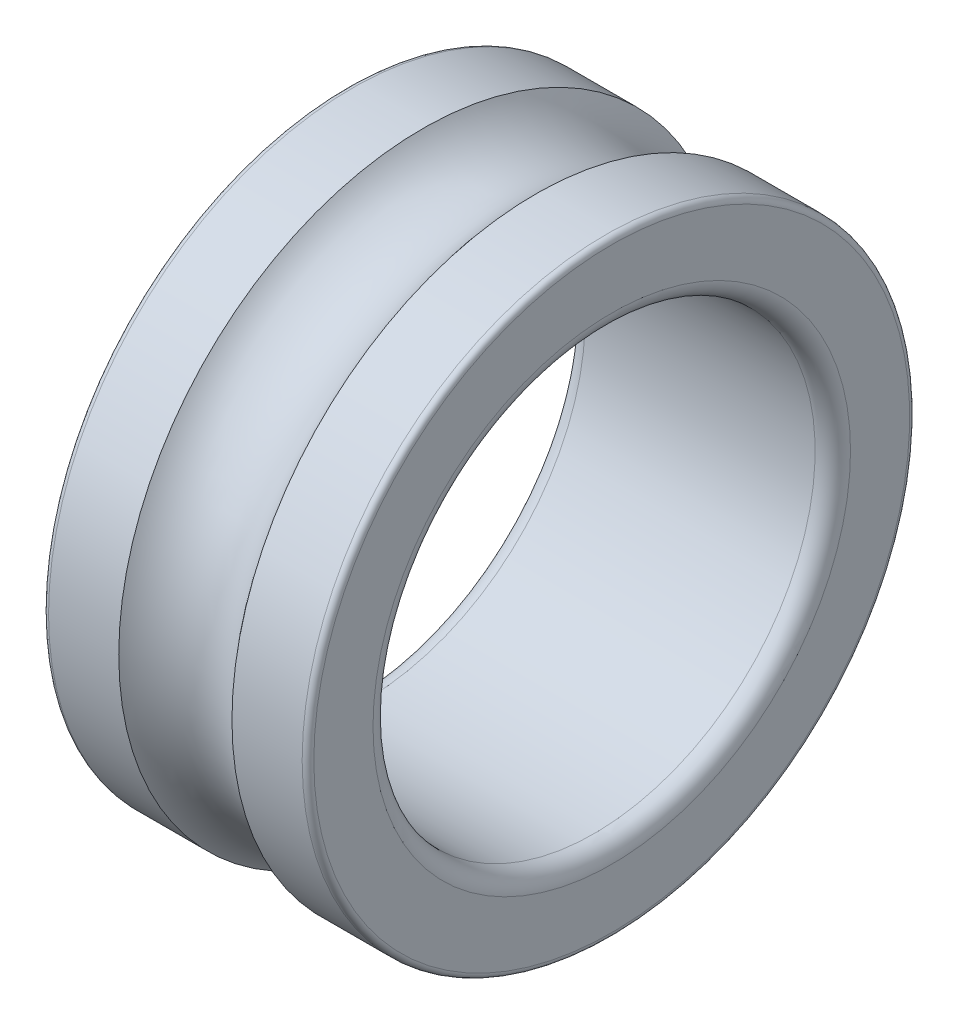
SolidWorks part; units mm, degrees
ref_plane "Přední rovina" through (0, 0, 0) normal (0, 0, 1) x (1, 0, 0)
ref_plane "Horní rovina" through (0, 0, 0) normal (0, 1, 0) x (1, 0, 0)
ref_plane "Pravá rovina" through (0, 0, 0) normal (1, 0, 0) x (0, 0, -1)
sketch "Skica1" plane through (0, 0, 0) normal (0, 0, 1) x (1, 0, 0)
  line L0 (0, 0) -> (74.6096, 0) construction
  line L1 (15, 13.5) -> (15, 16.845)
  line L2 (0, 50.998) -> (0, 0) construction
  line L3 (1, 12.5) -> (14, 12.5)
  line L4 (0, 16.845) -> (0, 13.5)
  line L11 (0.33, 17.175) -> (4.3, 17.175)
  line L12 (10.7, 17.175) -> (14.67, 17.175)
  arc A0 (1, 12.5) -> (0, 13.5) centre (1, 13.5) cw
  arc A1 (15, 13.5) -> (14, 12.5) centre (14, 13.5) cw
  arc A2 (14.67, 17.175) -> (15, 16.845) centre (14.67, 16.845) cw
  arc A3 (0.33, 17.175) -> (0, 16.845) centre (0.33, 16.845) ccw
  arc A4 (4.3, 17.175) -> (10.7, 17.175) centre (7.5, 19.523) ccw
  point P10 (0, 12.5)
  point P15 (15, 17.175)
  point P18 (0, 17.175)
  dimension "D4" = 1
  dimension "D5" = 0.33
  dimension "D1" = 12.5
  dimension "D2" = 17.175
  dimension "D3" = 15
  dimension "D6" = 4.3
  dimension "D9" = 6.4
revolve "Rotovat1" add sketch "Skica1" angle 360 about L0
